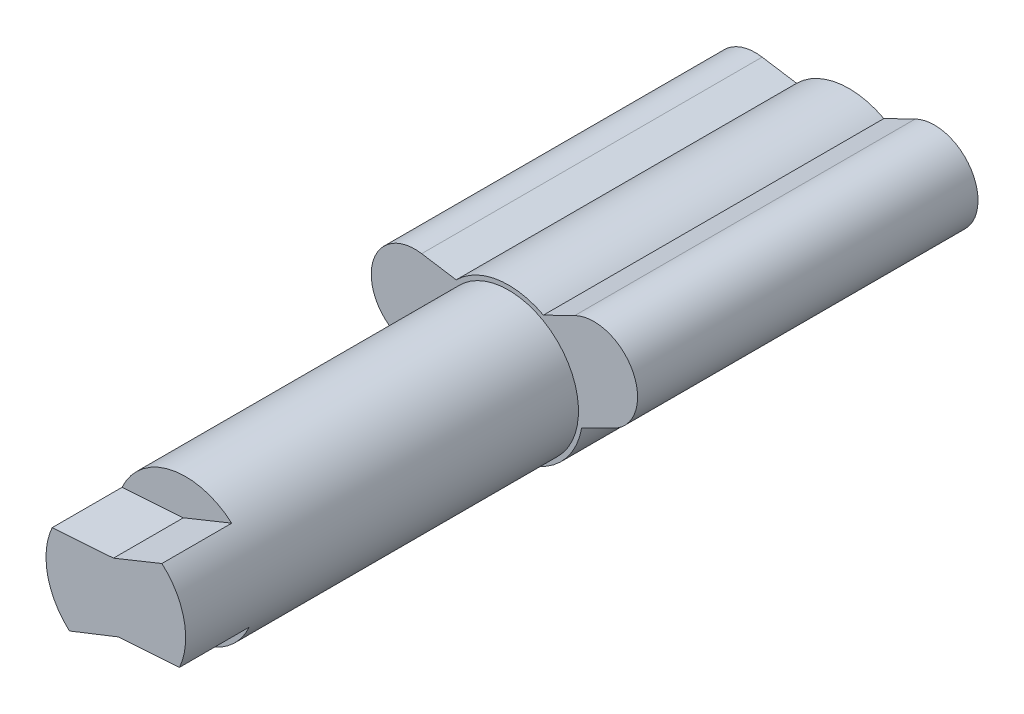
SolidWorks part; units mm, degrees
ref_plane "Plan de face" through (0, 0, 0) normal (0, 0, 1) x (1, 0, 0)
ref_plane "Plan de dessus" through (0, 0, 0) normal (0, 1, 0) x (1, 0, 0)
ref_plane "Plan de droite" through (0, 0, 0) normal (1, 0, 0) x (0, 0, -1)
sketch "Esquisse1" plane through (0, 0, 0) normal (0, 0, 1) x (1, 0, 0)
  circle A0 centre (0, 0) radius 4
  dimension "D1" = 8
extrude "Extrusion1" add sketch "Esquisse1" along normal blind 42
sketch "Esquisse2" plane through (0, 0, 42) normal (0, 0, 1) x (1, 0, 0)
  line L0 (0.132, -1.888) -> (3.6473, -1.6422)
  line L1 (-0.132, 1.888) -> (2.6385, 3.0064)
  line L2 (-0.132, 1.888) -> (-3.6473, 1.6422)
  line L3 (0.132, -1.888) -> (-2.6578, -2.9893)
  arc A0 (-2.6578, -2.9893) -> (3.6473, -1.6422) centre (0, 0) ccw
  circle A1 centre (0, 0) radius 4 construction
  arc A2 (-3.6473, 1.6422) -> (2.6385, 3.0064) centre (0, 0) cw
extrude "Enlèv. mat.-Extru.1" cut sketch "Esquisse2" against normal blind 4
sketch "Esquisse3" plane through (0, 0, 0) normal (0, 0, -1) x (-1, 0, 0)
  line L6 (5.7604, -1.6212) -> (3.7849, -1.9332)
  line L8 (3.0048, 3.0056) -> (4.9803, 3.3176)
  line L9 (-3.7888, 4.632) -> (-1.9915, 3.7545)
  line L11 (-4.1853, -0.7385) -> (-5.9826, 0.139)
  arc A6 (-4.1853, -0.7385) -> (3.7849, -1.9332) centre (0, 0) ccw
  arc A7 (4.9803, 3.3176) -> (5.7604, -1.6212) centre (5.3704, 0.8482) cw
  arc A8 (-5.9826, 0.139) -> (-3.7888, 4.632) centre (-4.8857, 2.3855) cw
  arc A9 (3.0048, 3.0056) -> (-1.9915, 3.7545) centre (0, 0) ccw
  dimension "D1" = 2
  dimension "D4" = 2
extrude "Extrusion2" add sketch "Esquisse3" against normal blind 19.5
